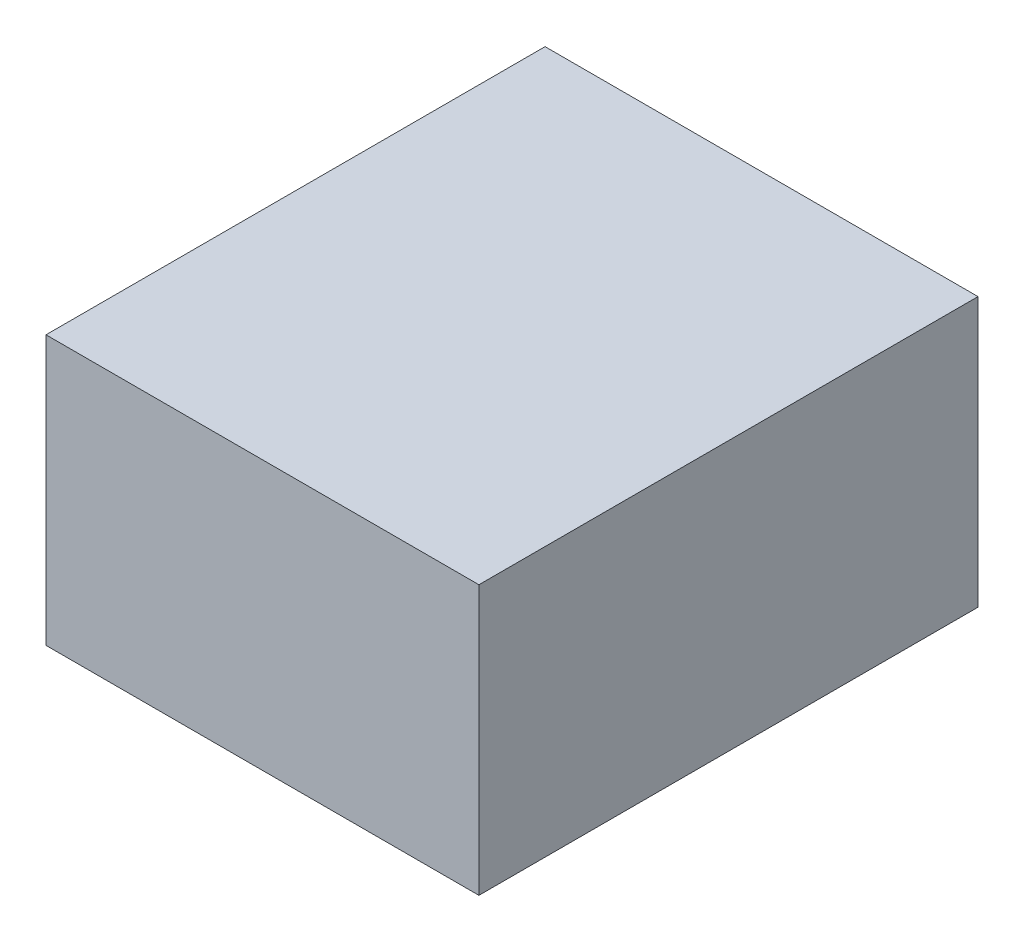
SolidWorks part; units mm, degrees
ref_plane "Front Plane" through (0, 0, 0) normal (0, 0, 1) x (1, 0, 0)
ref_plane "Top Plane" through (0, 0, 0) normal (0, 1, 0) x (1, 0, 0)
ref_plane "Right Plane" through (0, 0, 0) normal (1, 0, 0) x (0, 0, -1)
sketch "Sketch1" plane through (0, 0, 0) normal (0, 0, 1) x (1, 0, 0)
  line L0 (-63.7579, 39.6183) -> (63.7579, -39.6183) construction
  line L1 (-63.7579, -39.6183) -> (63.7579, -39.6183)
  line L2 (-63.7579, -39.6183) -> (-63.7579, 39.6183)
  line L3 (-63.7579, 39.6183) -> (63.7579, 39.6183)
  line L4 (63.7579, -39.6183) -> (63.7579, 39.6183)
extrude "Extrude1" add sketch "Sketch1" along normal mid plane 147
sketch "Sketch2" plane through (0, 0, 0) normal (1, 0, 0) x (0, 0, -1)
  spline S0 degree 3 poles (-73.5, 39.6183) (-67.4257, 45.713) (-53.0219, 60.1651) (-30.6726, 19.2448) (-0.5826, 69.2861) (32.1252, 10.8182) (46.4003, 59.3289) (64.2263, 46.3634) (73.5, 39.6183) knots 0 0 0 0 0.1216 0.288345 0.475012 0.705557 0.846821 1 1 1 1
